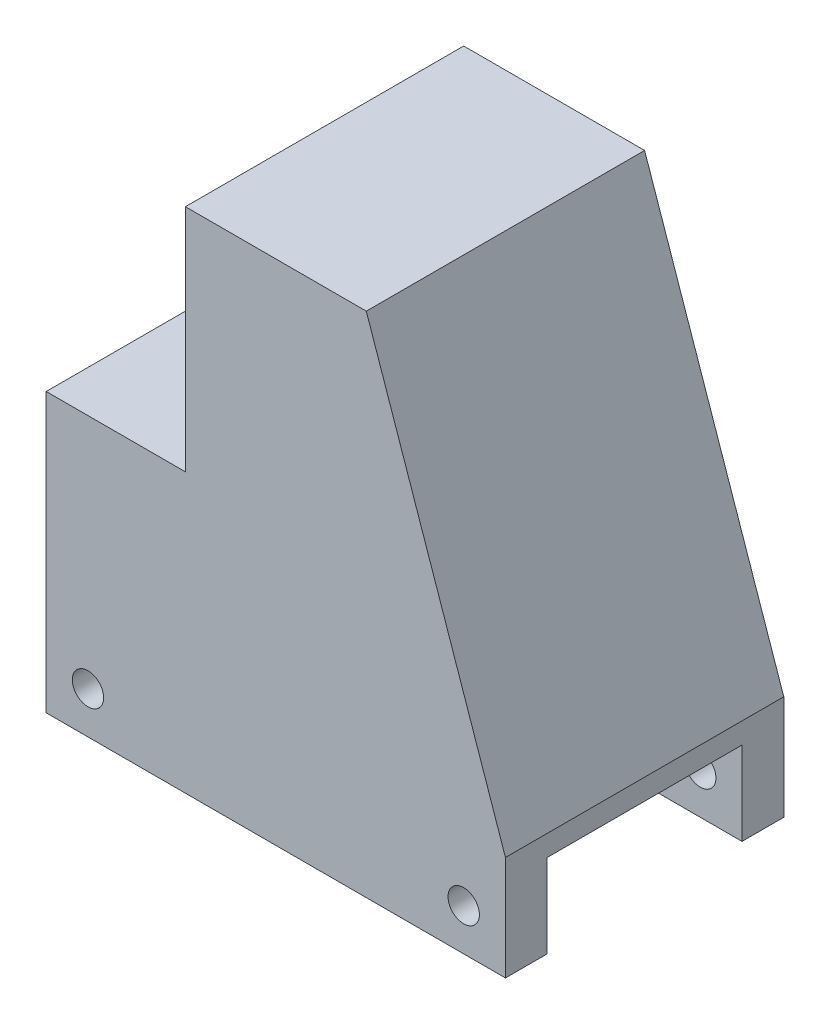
SolidWorks part; units mm, degrees
ref_plane "Спереди" through (0, 0, 0) normal (0, 0, 1) x (1, 0, 0)
ref_plane "Сверху" through (0, 0, 0) normal (0, 1, 0) x (1, 0, 0)
ref_plane "Справа" through (0, 0, 0) normal (1, 0, 0) x (0, 0, -1)
sketch "Эскиз1" plane through (0, 0, 0) normal (0, 0, 1) x (1, 0, 0)
  line L0 (-66, 0) -> (0, 0)
  line L1 (0, 0) -> (0, 15)
  line L2 (0, 15) -> (-20, 73)
  line L3 (-20, 73) -> (-46, 73)
  line L4 (-46, 73) -> (-46, 40)
  line L5 (-46, 40) -> (-66, 40)
  line L6 (-66, 40) -> (-66, 0)
  dimension "D1" = 73
  dimension "D2" = 66
  dimension "D3" = 33
  dimension "D4" = 20
  dimension "D5" = 46
  dimension "D6" = 15
extrude "Бобышка-Вытянуть1" add sketch "Эскиз1" against normal blind 40
hole_wizard "Диаметр отверстия Ø21.0 (21)1" positions "Эскиз3" profile "Эскиз2" hole size "Ø21.0" standard "ISO"
sketch "Эскиз3" plane through (-46, 0, 0) normal (-1, 0, 0) x (0, 0, 1)
  line L0 (-40, 73) -> (0, 73) construction
  point P0 (-20, 59)
  point P5 (-20, 73)
  dimension "D1" = 14
sketch "Эскиз2" plane through (-46, 59, -20) normal (0, 1, 0) x (0, 0, 1)
  line L0 (0, 0) -> (0, 27.3691)
  line L1 (0, 27.3691) -> (10.6, 21)
  line L2 (10.6, 21) -> (10.6, 0)
  line L5 (10.6, 0) -> (0, 0)
  line L10 (0, 27.3691) -> (-10.6, 21) construction
  line L11 (0, -6.35) -> (0, 107.95) construction
  dimension "Диаметр отверстия" = 21.2
  dimension "Глубина отверстия" = 21
  dimension "Угол заточки сверла" = 118
hole_wizard "Отверстие обработанное метчиком M41" positions "Эскиз5" profile "Эскиз4" tap size "M4" standard "DIN"
sketch "Эскиз5" plane through (0, 40, 0) normal (0, 1, 0) x (1, 0, 0)
  line L0 (-66, 40) -> (-66, 0) construction
  point P0 (-56, 20)
  point P5 (-66, 20)
  dimension "D1" = 10
sketch "Эскиз4" plane through (-56, 40, -20) normal (1, 0, 0) x (0, 0, 1)
  line L0 (0, 0) -> (0, 13.9914)
  line L1 (0, 13.9914) -> (1.65, 13)
  line L2 (1.65, 13) -> (1.65, 0)
  line L5 (1.65, 0) -> (0, 0)
  line L10 (0, 13.9914) -> (-1.65, 13) construction
  line L11 (0, -6.35) -> (0, 107.95) construction
  dimension "Диаметр сверла" = 3.3
  dimension "Глубина сверла" = 13
  dimension "Угол заточки сверла" = 118
chamfer "Фаска1" distance 0.5 angle 45 1 edges at (-56, 40, -18.35)
sketch "Эскиз6" plane through (-66, 0, 0) normal (-1, 0, 0) x (0, 0, 1)
  line L0 (-20, 0) -> (-20, 79.5058) construction
  line L1 (-40, 0) -> (0, 0) construction
  line L3 (-34, 0) -> (-6, 0)
  line L4 (-34, 0) -> (-34, 12)
  line L5 (-34, 12) -> (-6, 12)
  line L6 (-6, 0) -> (-6, 12)
  point P8 (-20, 0)
  dimension "D1" = 28
  dimension "D2" = 12
extrude "Вырез-Вытянуть1" cut sketch "Эскиз6" against normal through all
sketch "Эскиз7" plane through (0, 0, 0) normal (0, 0, 1) x (1, 0, 0)
  line L0 (-66, 0) -> (0, 0) construction
  line L1 (-66, 40) -> (-66, 0) construction
  circle A0 centre (-6, 6) radius 2.25
  circle A1 centre (-60, 6) radius 2.25
  dimension "D2" = 4.5
  dimension "D4" = 54
  dimension "D1" = 6
  dimension "D3" = 6
extrude "Вырез-Вытянуть2" cut sketch "Эскиз7" against normal through all
sketch "Эскиз8" plane through (0, 12, 0) normal (0, -1, 0) x (1, 0, 0)
  line L0 (-66, -6) -> (-66, -34) construction
  circle A0 centre (-33, -20) radius 8
  point P4 (-66, -20)
  dimension "D2" = 16
  dimension "D1" = 33
extrude "Вырез-Вытянуть3" cut sketch "Эскиз8" against normal up to next
